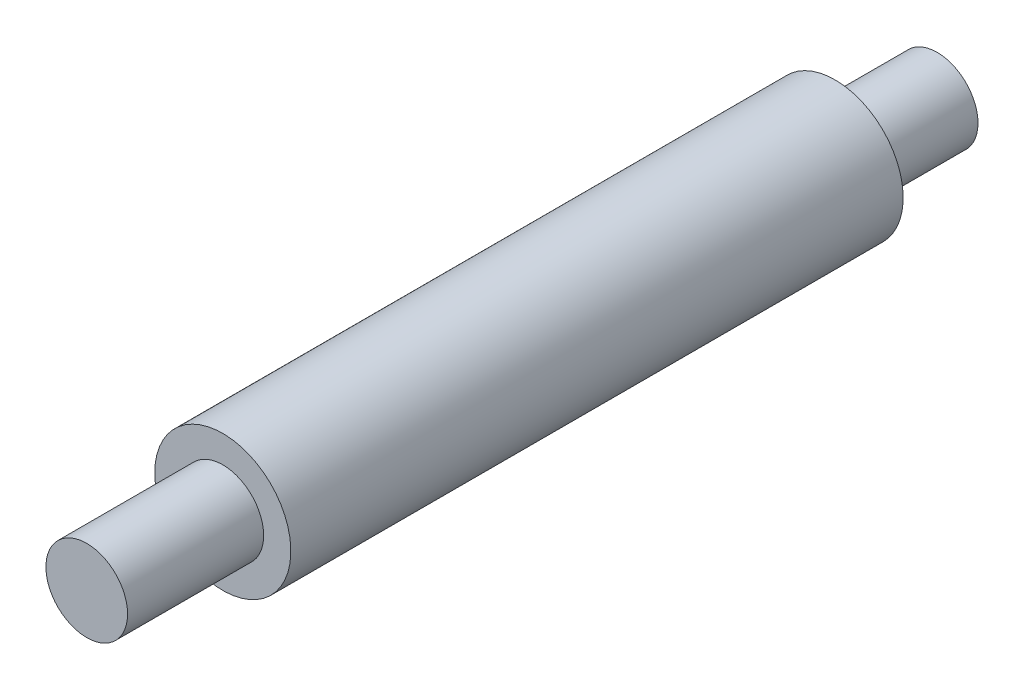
SolidWorks part; units mm, degrees
ref_plane "Спереди" through (0, 0, 0) normal (0, 0, 1) x (1, 0, 0)
ref_plane "Сверху" through (0, 0, 0) normal (0, 1, 0) x (1, 0, 0)
ref_plane "Справа" through (0, 0, 0) normal (1, 0, 0) x (0, 0, -1)
sketch "Эскиз1" plane through (0, 0, 0) normal (0, 0, 1) x (1, 0, 0)
  circle A0 centre (0, 0) radius 10
extrude "Бобышка-Вытянуть2" add sketch "Эскиз1" along normal blind 90 contours A0
sketch "Эскиз4" plane through (0, 0, 90) normal (0, 0, 1) x (1, 0, 0)
  circle A0 centre (0, 0) radius 6
extrude "Бобышка-Вытянуть3" add sketch "Эскиз4" along normal blind 20
sketch "Эскиз5" plane through (0, 0, 0) normal (0, 0, -1) x (-1, 0, 0)
  circle A0 centre (0, 0) radius 6
extrude "Бобышка-Вытянуть4" add sketch "Эскиз5" along normal blind 15
sketch3d "Sketch_MAC1-1_MAIN_SHAFT_MILLTURNFULL" [suppressed]
  line L0 (0, 0, 110) -> (10, 0, 110)
  line L1 (0, 0, 110) -> (0, 0, 100)
  point P0 (0, 0, 110)
  point P1 (10, 0, 110)
  point P2 (0, 0, 100)
sketch3d "3D SketchPlane_HomeZX1_MAIN_SHAFT_MILLTURNFULL" [suppressed]
  point P0 (0, 0, 110)
  point P1 (0, 10, 110)
  point P2 (10, 0, 110)
ref_plane "Plane_HomeZX1_MAIN_SHAFT_MILLTURNFULL" [suppressed] through (0, 0, 110) normal (0, 0, -1) x (-1, 0, 0)
sketch "stock_Envelope_MAIN_SHAFT_MILLTURNFULL" plane through (0, 0, 110) normal (0, 0, -1) x (-1, 0, 0)
  line L0 (0, -20) -> (-126.1439, -20)
  line L1 (-126.1439, -20) -> (-126.1439, 11)
  line L2 (-126.1439, 11) -> (0, 11)
  line L3 (0, 11) -> (0, -20)
sketch3d "Sketch_MAC1-2_MAIN_SHAFT_MILLTURNFULL" [suppressed]
  line L0 (0, 0, 110) -> (10, 0, 110)
  line L1 (0, 0, 110) -> (0, 10, 110)
  point P0 (0, 0, 110)
  point P1 (10, 0, 110)
  point P2 (0, 10, 110)
sketch "target_Envelope_MAIN_SHAFT_MILLTURNFULL" plane through (0, 0, 110) normal (0, 0, -1) x (-1, 0, 0)
  line L0 (-20, -10) -> (-20, -6)
  line L1 (-20, -6) -> (0, -6)
  line L2 (0, -6) -> (0, 6)
  line L3 (0, 6) -> (-20, 6)
  line L4 (-20, 6) -> (-20, 10)
  line L5 (-20, 10) -> (-110, 10)
  line L6 (-110.2905, 6) -> (-125, 6)
  line L7 (-125, -6) -> (-110.2905, -6)
  line L8 (-110, -10) -> (-20, -10)
  arc A0 (-110, 10) -> (-110.2905, 6) centre (0, 0) ccw
  arc A1 (-125, 6) -> (-125.1439, 0) centre (0, 0) ccw
  arc A2 (-125.1439, 0) -> (-125, -6) centre (0, 0) ccw
  arc A3 (-110.2905, -6) -> (-110, -10) centre (0, 0) ccw
sketch3d "Sketch_MAC1-3_MAIN_SHAFT_MILLTURNFULL" [suppressed]
  line L0 (0, 0, 110) -> (10, 0, 110)
  line L1 (0, 0, 110) -> (0, 10, 110)
  point P0 (0, 0, 110)
  point P1 (10, 0, 110)
  point P2 (0, 10, 110)
